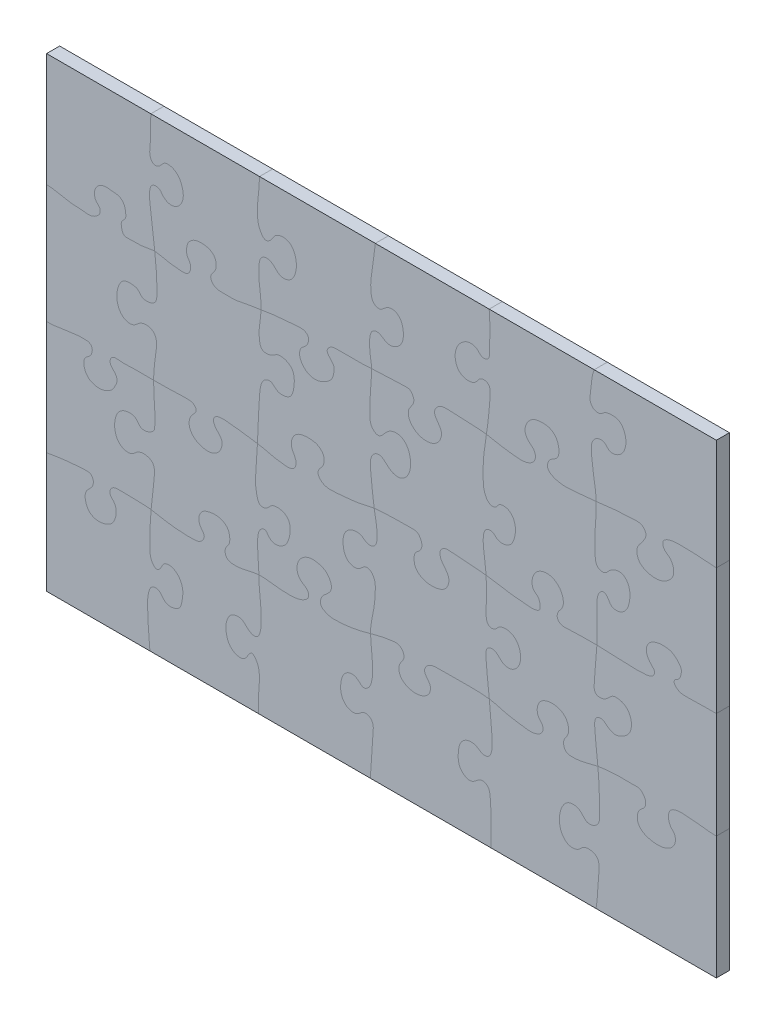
SolidWorks part; units mm, degrees
ref_plane "Front Plane" through (0, 0, 0) normal (0, 0, 1) x (1, 0, 0)
ref_plane "Top Plane" through (0, 0, 0) normal (0, 1, 0) x (1, 0, 0)
ref_plane "Right Plane" through (0, 0, 0) normal (1, 0, 0) x (0, 0, -1)
sketch "Sketch1" plane through (0, 0, 0) normal (0, 0, 1) x (1, 0, 0)
  line L1 (512, -356) -> (-512, -356)
  line L2 (512, -356) -> (512, 356)
  line L3 (512, 356) -> (-512, 356)
  line L4 (-512, -356) -> (-512, 356)
  line L5 (512, -356) -> (-512, 356) construction
  line L6 (512, 356) -> (-512, -356) construction
  point P0 (0, 0)
  dimension "D1" = 1024
  dimension "D2" = 712
extrude "Boss-Extrude1" add sketch "Sketch1" along normal blind 20
sketch "Sketch2"
ref_plane "Plane1" through (0, 0, 66.5) normal (0, 0, 1) x (1, 0, 0)
sketch "Sketch4" plane through (0, 0, 66.5) normal (0, 0, 1) x (1, 0, 0)
  line L3 (-512, 356) -> (-512, -356) construction
  line L4 (512, -356) -> (512, 356) construction
  spline S2 degree 3 poles (-346.614, 177.2529) (-353.9817, 176.3493) (-366.6419, 173.3265) (-381.5936, 173.9186) (-395.1084, 172.8576) (-397.652, 183.1989) (-398.3748, 191.7843) (-389.7892, 197.0368) (-391.1222, 207.1088) (-393.0484, 215.7538) (-399.6639, 223.1738) (-411.9019, 223.9772) (-424.6803, 225.9194) (-436.6203, 218.7953) (-440.0133, 207.3799) (-436.7345, 197.5131) (-429.5585, 192.9427) (-429.8935, 184.1726) (-435.9793, 178.2641) (-445.5638, 173.7748) (-458.2938, 176.4075) (-471.9554, 175.97) (-490.0323, 179.4839) (-502.9946, 182.4127) (-512, 182.5472) knots 0 0 0 0 0.087866 0.143852 0.183815 0.220831 0.250252 0.276671 0.322752 0.351256 0.381586 0.429302 0.487319 0.528414 0.578655 0.612481 0.64265 0.668895 0.700902 0.736877 0.787346 0.8461 0.895896 1 1 1 1
  spline S4 degree 3 poles (-349.1399, 5.3005) (-358.4555, 4.7169) (-375.8662, 6.3087) (-395.5506, 3.931) (-410.0566, 6.5919) (-415.1771, -0.054) (-414.8887, -6.472) (-410.6152, -11.3677) (-405.9461, -15.9106) (-403.2343, -23.3042) (-406.8337, -31.093) (-410.8538, -39.2871) (-419.0043, -44.0985) (-428.1502, -47.5131) (-438.16, -46.756) (-447.284, -42.9287) (-452.812, -35.8307) (-455.6165, -27.1098) (-454.4251, -16.203) (-445.8348, -12.478) (-442.1367, -5.499) (-441.5, 2.6111) (-447.0505, 6.4724) (-455.352, 7.1448) (-475.815, 6.5515) (-496.7334, 0.8894) (-512, 1.2322) knots 0 0 0 0 0.10377 0.188953 0.228152 0.248846 0.272575 0.293053 0.318864 0.345389 0.373108 0.410114 0.444785 0.47422 0.517541 0.552254 0.580697 0.613691 0.654174 0.686129 0.70788 0.740269 0.764852 0.773557 0.827314 1 1 1 1
  spline S5 degree 3 number of poles 125 (-346.614, 177.2529) -> (512, 187.0765)
  spline S6 degree 3 number of poles 125 (-349.1399, 5.3005) -> (512, -5.817)
  spline S7 degree 3 number of poles 132 (-512, -172.5193) -> (512, -168.0729)
split "Split1" trim tools "Sketch4" bodies to split 101 resulting bodies 115 116 117 118
sketch "Sketch6" plane through (0, 0, 66.5) normal (0, 0, 1) x (1, 0, 0)
  line L0 (512, 356) -> (-512, 356) construction
  line L1 (-512, -356) -> (512, -356) construction
  spline S0 degree 3 number of poles 77 (-352.5346, 356) -> (-354.0351, -356)
  spline S1 degree 3 number of poles 132 (-512, -172.5193) -> (512, -168.0729) construction
  spline S2 degree 3 number of poles 68 (-186.3932, 356) -> (-188.1977, -356)
  spline S3 degree 3 number of poles 70 (-9.3908, 356) -> (-17.0262, -356)
  spline S4 degree 3 number of poles 68 (164.7005, 356) -> (167.1264, -356)
  spline S5 degree 3 number of poles 74 (325.2571, 356) -> (328.1247, -356)
split "Split2" trim tools "Sketch6" bodies to split 118 117 116 115 resulting bodies 143 144 145 146 147 148 149 150 151 152 153 154 155 156 157 158 159 160 161 162 163 164 165 166
other "Save Bodies1"
